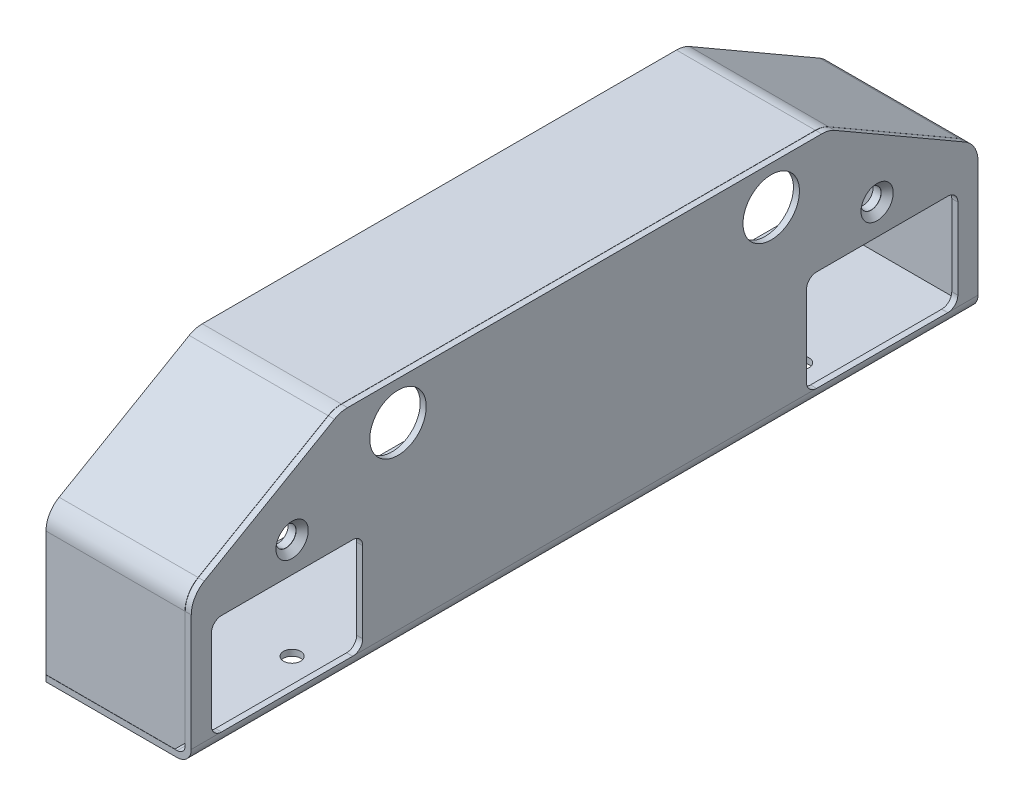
SolidWorks part; units mm, degrees
ref_plane "Face" through (0, 0, 0) normal (0, 0, 1) x (1, 0, 0)
ref_plane "Dessus" through (0, 0, 0) normal (0, 1, 0) x (1, 0, 0)
ref_plane "Droite" through (0, 0, 0) normal (1, 0, 0) x (0, 0, -1)
sketch "Esquisse1" plane through (0, 0, 0) normal (0, 0, 1) x (1, 0, 0)
  line L0 (0, 0) -> (0, -108)
  line L3 (0, 0) -> (3, 0)
  line L4 (3, 0) -> (3, -108)
  line L5 (-4, -115) -> (-69, -115)
  line L6 (-4, -112) -> (-69, -112)
  line L7 (-69, -112) -> (-69, -115)
  arc A2 (-4, -112) -> (0, -108) centre (-4, -108) ccw
  arc A3 (-4, -115) -> (3, -108) centre (-4, -108) ccw
  point P9 (0, 0)
  dimension "D9" = 4
  dimension "D10" = 7
  dimension "D2" = 3
  dimension "D3" = 115
  dimension "D7" = 3
  dimension "D8" = 72
extrude "Extrusion1" add sketch "Esquisse1" along normal mid plane 390
sketch "Esquisse4" plane through (3, 0, 0) normal (1, 0, 0) x (0, 0, -1)
  line L0 (-195, 0) -> (195, 0) construction
  circle A0 centre (92.5, -19) radius 14
  circle A1 centre (-92.5, -19) radius 14
  dimension "D4" = 185
  dimension "D2" = 19
  dimension "D1" = 28
  dimension "D3" = 92.5
extrude "Enlèv. mat.-Extru.3" cut sketch "Esquisse4" against normal blind 4
sketch "Esquisse6" plane through (0, -115, 0) normal (0, -1, 0) x (1, 0, 0)
  line L1 (-69, 195) -> (-69, -195) construction
  line L2 (-55, 14) -> (-69, 28)
  line L3 (-69, 28) -> (-69, -28)
  line L4 (-69, -28) -> (-55, -14)
  arc A0 (-55, 14) -> (-55, -14) centre (-55, 0) cw
  dimension "D4" = 45
  dimension "D1" = 14
  dimension "D2" = 14
  dimension "D3" = 45
extrude "Enlèv. mat.-Extru.5" cut sketch "Esquisse6" against normal blind 3
sketch "Esquisse7" plane through (3, 0, 0) normal (1, 0, 0) x (0, 0, -1)
  line L1 (-180, -108) -> (-115, -108)
  line L2 (-185, -103) -> (-185, -63)
  line L3 (-180, -58) -> (-115, -58)
  line L4 (-110, -103) -> (-110, -63)
  line L5 (115, -108) -> (180, -108)
  line L6 (110, -103) -> (110, -63)
  line L7 (115, -58) -> (180, -58)
  line L8 (185, -103) -> (185, -63)
  line L9 (-195, 0) -> (195, 0) construction
  arc A0 (-185, -63) -> (-180, -58) centre (-180, -63) cw
  arc A1 (-180, -108) -> (-185, -103) centre (-180, -103) cw
  arc A2 (-110, -103) -> (-115, -108) centre (-115, -103) cw
  arc A3 (-110, -63) -> (-115, -58) centre (-115, -63) ccw
  arc A4 (110, -63) -> (115, -58) centre (115, -63) cw
  arc A5 (115, -108) -> (110, -103) centre (115, -103) cw
  arc A6 (185, -103) -> (180, -108) centre (180, -103) cw
  arc A7 (185, -63) -> (180, -58) centre (180, -63) ccw
  dimension "D7" = 5
  dimension "D1" = 75
  dimension "D2" = 75
  dimension "D3" = 50
  dimension "D4" = 110
  dimension "D5" = 110
  dimension "D6" = 58
extrude "Enlèv. mat.-Extru.6" cut sketch "Esquisse7" against normal blind 3
sketch "Esquisse10" plane through (3, 0, 0) normal (1, 0, 0) x (0, 0, -1)
  line L0 (-195, -42.7239) -> (-121, 0)
  line L1 (-195, -108) -> (-195, 0) construction
  line L2 (-195, 0) -> (195, 0) construction
  line L3 (-121, 0) -> (-195, 0)
  line L4 (-195, 0) -> (-195, -42.7239)
  line L5 (121, 0) -> (195, 0)
  line L6 (195, 0) -> (195, -42.7239)
  line L7 (195, -108) -> (195, 0) construction
  line L8 (195, -42.7239) -> (121, 0)
  dimension "D1" = 74
  dimension "D2" = 30
  dimension "D3" = 74
  dimension "D4" = 30
extrude "Enlèv. mat.-Extru.8" cut sketch "Esquisse10" against normal blind 3
fillet "Congé2" radius 13 4 edges at (1.5, -42.7239, -195) (1.5, 0, -121) (1.5, 0, 121) (1.5, -42.7239, 195)
sketch "Esquisse11" plane through (-69, 0, 0) normal (-1, 0, 0) x (0, 0, 1)
  line L0 (195, -111.9) -> (195, -50.2295)
  line L1 (-195, -50.2295) -> (-195, -108) construction
  line L2 (-124.0167, -1.7417) -> (-188.5, -38.9711) construction
  line L3 (117.5167, 0) -> (-117.5167, 0) construction
  line L4 (188.5, -38.9711) -> (124.0167, -1.7417) construction
  line L5 (-195, -50.2295) -> (-195, -111.9)
  line L6 (-124.0167, -1.7417) -> (-188.5, -38.9711)
  line L7 (117.5167, 0) -> (-117.5167, 0)
  line L8 (188.5, -38.9711) -> (124.0167, -1.7417)
  line L9 (192, -111.9) -> (192, -50.2295)
  line L10 (187, -41.5692) -> (122.5167, -4.3397)
  line L11 (117.5167, -3) -> (-117.5167, -3)
  line L12 (-122.5167, -4.3397) -> (-187, -41.5692)
  line L13 (-192, -50.2295) -> (-192, -111.9)
  line L14 (192, -111.9) -> (195, -111.9)
  line L15 (-195, -111.9) -> (-192, -111.9)
  line L17 (195, -112) -> (-195, -112) construction
  arc A0 (-188.5, -38.9711) -> (-195, -50.2295) centre (-182, -50.2295) ccw construction
  arc A1 (-117.5167, 0) -> (-124.0167, -1.7417) centre (-117.5167, -13) ccw construction
  arc A2 (124.0167, -1.7417) -> (117.5167, 0) centre (117.5167, -13) ccw construction
  arc A3 (195, -50.2295) -> (188.5, -38.9711) centre (182, -50.2295) ccw construction
  arc A4 (-188.5, -38.9711) -> (-195, -50.2295) centre (-182, -50.2295) ccw
  arc A5 (-117.5167, 0) -> (-124.0167, -1.7417) centre (-117.5167, -13) ccw
  arc A6 (124.0167, -1.7417) -> (117.5167, 0) centre (117.5167, -13) ccw
  arc A7 (195, -50.2295) -> (188.5, -38.9711) centre (182, -50.2295) ccw
  arc A8 (192, -50.2295) -> (187, -41.5692) centre (182, -50.2295) ccw
  arc A9 (122.5167, -4.3397) -> (117.5167, -3) centre (117.5167, -13) ccw
  arc A10 (-117.5167, -3) -> (-122.5167, -4.3397) centre (-117.5167, -13) ccw
  arc A11 (-187, -41.5692) -> (-192, -50.2295) centre (-182, -50.2295) ccw
  dimension "D2" = 0.1
  dimension "D3" = 0.1
  dimension "D1" = 3
extrude "Extrusion2" add sketch "Esquisse11" against normal blind 68.9 separate body
chamfer "Chanfrein4" distance 5 angle 45 2 edges at (-0.1, -111.9, -193.5) (-0.1, -111.9, 193.5)
sketch "Esquisse12" plane through (3, 0, 0) normal (1, 0, 0) x (0, 0, -1)
  circle A0 centre (-145, -43) radius 4.25
  circle A1 centre (145, -43) radius 4.25
  dimension "D1" = 8.5
  dimension "D2" = 8.5
  dimension "D3" = 145
  dimension "D4" = 290
  dimension "D5" = 43
extrude "Enlèv. mat.-Extru.9" cut sketch "Esquisse12" against normal blind 5
sketch "Esquisse13" plane through (0, -115, 0) normal (0, -1, 0) x (1, 0, 0)
  line L0 (3, 195) -> (3, 180) construction
  line L1 (0, 0) -> (-89.1576, 0) construction
  circle A0 centre (-16, 126) radius 4.25
  circle A1 centre (-16, -126) radius 4.25
  circle A2 centre (-57, 62.5) radius 4.25
  circle A3 centre (-57, -62.5) radius 4.25
  dimension "D1" = 8.5
  dimension "D2" = 8.5
  dimension "D3" = 126
  dimension "D4" = 126
  dimension "D5" = 19
  dimension "D6" = 125
  dimension "D7" = 41
extrude "Enlèv. mat.-Extru.10" cut sketch "Esquisse13" against normal blind 5
ref_plane "Plan1" through (0, -43, 0) normal (0, 1, 0) x (-1, 0, 0)
sketch "Esquisse14" plane through (0, -43, 0) normal (0, 1, 0) x (-1, 0, 0)
  line L0 (-14.3596, 145) -> (19.0381, 145) construction
  line L1 (-3, 145) -> (-3, 153)
  line L2 (-3, 188.5) -> (-3, 124.0167) construction
  line L3 (-3, 153) -> (5, 145)
  line L4 (5, 145) -> (-3, 145)
  dimension "D1" = 145
  dimension "D2" = 16
  dimension "D3" = 45
revolve "Enlèvement de matière-Révolution1" cut sketch "Esquisse14" angle 360 about L0
mirror "Symétrie1" about plane through (0, 0, 0) normal (0, 0, 1) of "Enlèvement de matière-Révolution1"
sketch "Esquisse15" plane through (0, 0, 0) normal (-1, 0, 0) x (0, 0, 1)
  line L1 (-152.5, -35.5) -> (152.5, -35.5)
  line L2 (-152.5, -35.5) -> (-152.5, -50.5)
  line L3 (-152.5, -50.5) -> (152.5, -50.5)
  line L4 (152.5, -35.5) -> (152.5, -50.5)
  circle A0 centre (-145, -43) radius 5 construction
  circle A1 centre (145, -43) radius 5 construction
  circle A2 centre (-145, -43) radius 5
  circle A3 centre (145, -43) radius 5
  dimension "D1" = 15
  dimension "D2" = 7.5
  dimension "D3" = 7.5
  dimension "D4" = 7.5
extrude "Extrusion3" add sketch "Esquisse15" along normal blind 3.9 from offset 0.1
sketch "Esquisse16" plane through (-69, 0, 0) normal (-1, 0, 0) x (0, 0, 1)
  line L0 (122.4667, -4.4263) -> (186.9, -41.627)
  line L1 (102.3694, -3.1) -> (191.9, -54.7905)
  line L2 (188.5, -38.9711) -> (124.0167, -1.7417) construction
  line L3 (122.5167, -4.3397) -> (187, -41.5692) construction
  line L6 (-117.5167, -3) -> (117.5167, -3) construction
  line L7 (102.3694, -3.1) -> (117.5167, -3.1)
  line L105 (191.9, -54.7905) -> (191.9, -50.2872)
  line L106 (192, -50.2295) -> (192, -111.9) construction
  line L107 (0, 0) -> (0, 12.8678) construction
  line L108 (-191.9, -54.7905) -> (-191.9, -50.2872)
  line L109 (-102.3694, -3.1) -> (-117.5167, -3.1)
  line L110 (-102.3694, -3.1) -> (-191.9, -54.7905)
  line L111 (-122.4667, -4.4263) -> (-186.9, -41.627)
  arc A2 (-186.9, -41.627) -> (-191.9, -50.2872) centre (-181.9, -50.2872) ccw
  arc A3 (122.4667, -4.4263) -> (117.5167, -3.1) centre (117.5167, -13) ccw
  arc A87 (186.9, -41.627) -> (191.9, -50.2872) centre (181.9, -50.2872) cw
  arc A88 (-122.4667, -4.4263) -> (-117.5167, -3.1) centre (-117.5167, -13) cw
  dimension "D6" = 10
  dimension "D1" = 0.1
  dimension "D2" = 9
  dimension "D5" = 0.1
  dimension "D3" = 0.1
extrude "Extrusion4" add sketch "Esquisse16" against normal blind 3
